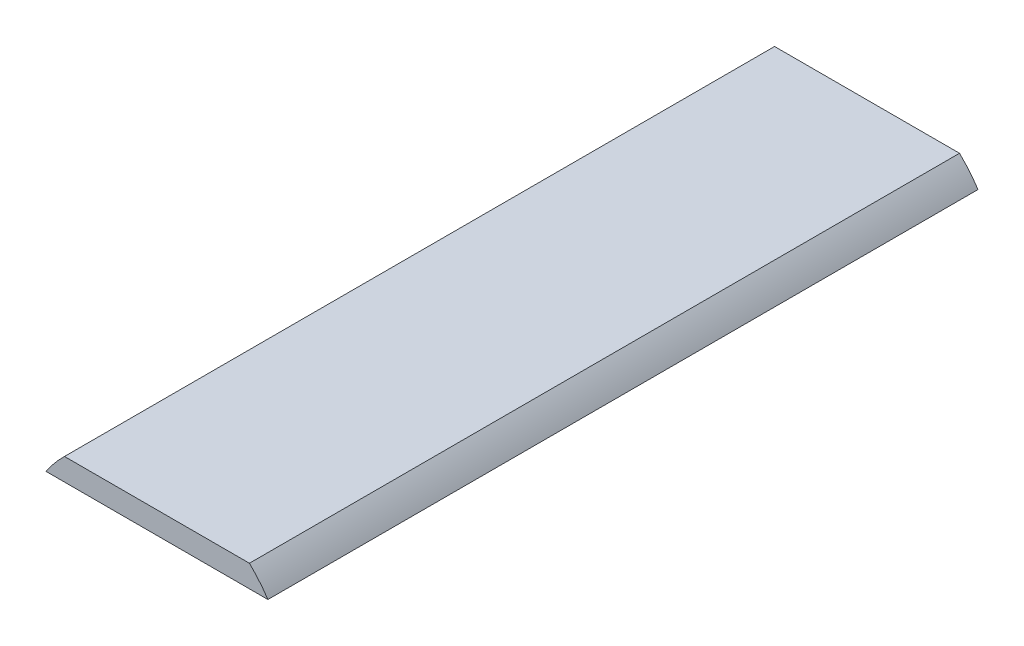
SolidWorks part; units mm, degrees
ref_plane "Front Plane" through (0, 0, 0) normal (0, 0, 1) x (1, 0, 0)
ref_plane "Top Plane" through (0, 0, 0) normal (0, 1, 0) x (1, 0, 0)
ref_plane "Right Plane" through (0, 0, 0) normal (1, 0, 0) x (0, 0, -1)
sketch "Sketch1" plane through (0, 0, 0) normal (0, 0, 1) x (1, 0, 0)
  circle A0 centre (0, 0) radius 19.05
  dimension "D1" = 38.1
extrude "Extrude1" add sketch "Sketch1" along normal blind 101.6
sketch "Sketch2" plane through (0, 0, 101.6) normal (0, 0, 1) x (1, 0, 0)
  line L0 (-13.2313, 13.7053) -> (13.2313, 13.7053)
  line L1 (-15.875, 10.5303) -> (15.875, 10.5303)
  circle A0 centre (0, 0) radius 19.05 construction
  arc A1 (-15.875, 10.5303) -> (15.875, 10.5303) centre (0, 0) ccw
  arc A2 (-13.2313, 13.7053) -> (13.2313, 13.7053) centre (0, 0) cw
  dimension "D1" = 3.175
  dimension "D2" = 31.75
extrude "Cut-Extrude1" cut sketch "Sketch2" against normal through all
sketch "Sketch3" plane through (0, 0, 0) normal (0, 0, -1) x (-1, 0, 0)
  line L2 (-15.875, 10.5303) -> (15.875, 10.5303)
  line L3 (13.2313, 13.7053) -> (-13.2313, 13.7053)
  line L4 (-15.875, 10.5303) -> (15.875, 10.5303)
  line L5 (13.2313, 13.7053) -> (-13.2313, 13.7053)
  arc A2 (-13.2313, 13.7053) -> (-15.875, 10.5303) centre (0, 0) ccw
  arc A3 (15.875, 10.5303) -> (13.2313, 13.7053) centre (0, 0) ccw
  arc A4 (-13.2313, 13.7053) -> (-15.875, 10.5303) centre (0, 0) ccw
  arc A5 (15.875, 10.5303) -> (13.2313, 13.7053) centre (0, 0) ccw
  dimension "D1" = 0
